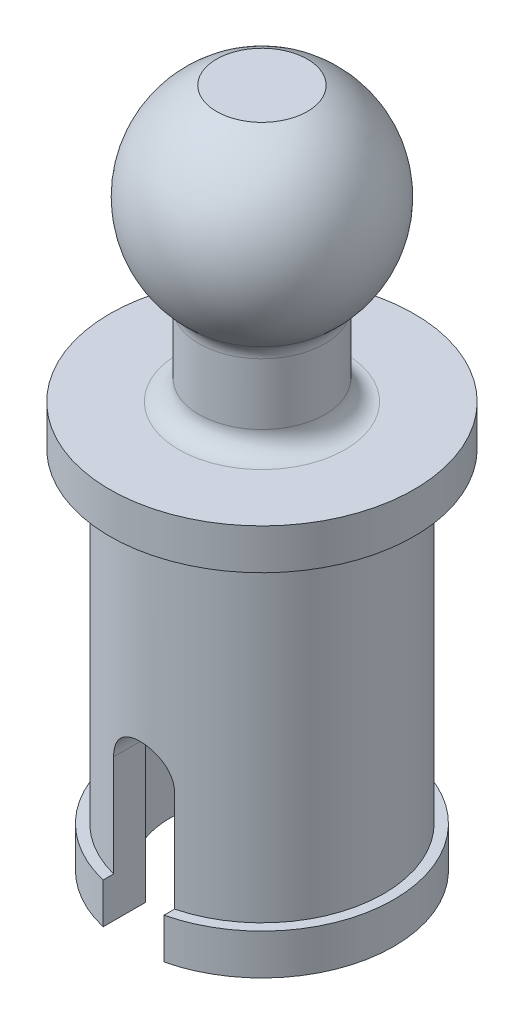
SolidWorks part; units mm, degrees
ref_plane "정면" through (0, 0, 0) normal (0, 0, 1) x (1, 0, 0)
ref_plane "윗면" through (0, 0, 0) normal (0, 1, 0) x (1, 0, 0)
ref_plane "우측면" through (0, 0, 0) normal (1, 0, 0) x (0, 0, -1)
sketch "스케치1" plane through (0, 0, 0) normal (0, 0, 1) x (1, 0, 0)
  line L0 (0, 16.8807) -> (0, -3.9493) construction
  line L1 (1.24, 8) -> (3, 8)
  line L2 (3, 8) -> (3, 7.2)
  line L3 (3, 7.2) -> (2.4, 7.2)
  line L4 (2.4, 7.2) -> (2.4, 0.8)
  line L5 (2.4, 0.8) -> (2.6, 0.8)
  line L6 (2.6, 0.8) -> (2.6, 0)
  line L7 (2.6, 0) -> (0, 0)
  line L8 (0, 13.4) -> (0.8949, 13.4)
  line L9 (1.24, 8) -> (1.24, 9.8)
  line L10 (0, 13.4) -> (0, 0) construction
  line L11 (0, 13.4) -> (0, 0)
  arc A0 (1.24, 9.8) -> (0.8949, 13.4) centre (0, 11.4977) ccw
  dimension "D8" = 2.1023
  dimension "D1" = 3
  dimension "D2" = 2.4
  dimension "D3" = 2.6
  dimension "D4" = 0.8
  dimension "D5" = 0.8
  dimension "D6" = 8
  dimension "D7" = 1.8
  dimension "D9" = 1.24
  dimension "D10" = 5.4
revolve "회전1" add sketch "스케치1" angle 360 about L0
sketch "스케치2" plane through (0, 0, 0) normal (0, 0, 1) x (1, 0, 0)
  line L0 (-0.6, 0) -> (-0.6, 2.8)
  line L1 (-2.6, 0) -> (2.6, 0) construction
  line L2 (0.6, 2.8) -> (0.6, 0)
  line L3 (0.6, 0) -> (-0.6, 0)
  line L4 (0, 0) -> (0, 4.3117) construction
  arc A0 (-0.6, 2.8) -> (0.6, 2.8) centre (0, 2.8) cw
  dimension "D1" = 1.2
  dimension "D2" = 2.8
extrude "컷-돌출1" cut sketch "스케치2" against normal through all both and the other way through all
sketch "스케치3" plane through (0, 0, 0) normal (0, -1, 0) x (1, 0, 0)
  circle A0 centre (0, 0) radius 1.8
  dimension "D1" = 3.6
extrude "컷-돌출2" cut sketch "스케치3" against normal blind 7.2
fillet "필렛1" radius 0.4 2 edges at (-1.24, 9.8, 0) (-1.24, 8, 0)
